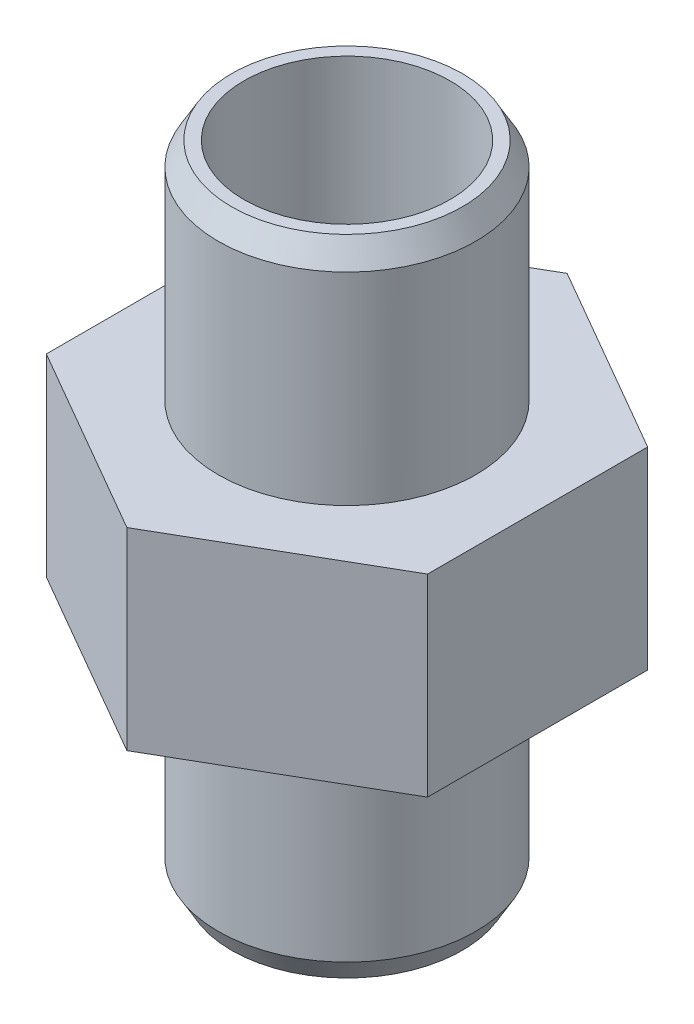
SolidWorks part; units mm, degrees
ref_plane "Front Plane" through (0, 0, 0) normal (0, 0, 1) x (1, 0, 0)
ref_plane "Top Plane" through (0, 0, 0) normal (0, 1, 0) x (1, 0, 0)
ref_plane "Right Plane" through (0, 0, 0) normal (1, 0, 0) x (0, 0, -1)
sketch "Sketch1" plane through (0, 0, 0) normal (0, 0, 1) x (1, 0, 0)
  line L0 (0, 27.4512) -> (0, -29.306) construction
  line L1 (0, 15.875) -> (6.35, 15.875)
  line L2 (6.35, 15.875) -> (6.35, 4.7625)
  line L3 (6.35, 4.7625) -> (12.7, 4.7625)
  line L4 (12.7, 4.7625) -> (12.7, -4.7625)
  line L5 (12.7, -4.7625) -> (6.35, -4.7625)
  line L6 (6.35, -4.7625) -> (6.35, -15.875)
  line L7 (6.35, -15.875) -> (0, -15.875)
  line L8 (0, 15.875) -> (0, -15.875)
  point P5 (12.7, 0)
  dimension "D1" = 12.7
  dimension "D2" = 9.525
  dimension "D3" = 31.75
  dimension "D4" = 15.875
  dimension "D5" = 25.4
revolve "Revolve1" add sketch "Sketch1" angle 360 about L0
sketch "Sketch2" plane through (0, 15.875, 0) normal (0, 1, 0) x (-1, 0, 0)
  circle A0 centre (0, 0) radius 5.08
  dimension "D1" = 10.16
extrude "Cut-Extrude1" cut sketch "Sketch2" against normal through all
sketch "Sketch3" plane through (0, 4.7625, 0) normal (0, 1, 0) x (-1, 0, 0)
  line L1 (0, 10.8519) -> (-9.398, 5.4259)
  line L2 (-9.398, 5.4259) -> (-9.398, -5.4259)
  line L3 (-9.398, -5.4259) -> (0, -10.8519)
  line L4 (0, -10.8519) -> (9.398, -5.4259)
  line L5 (9.398, -5.4259) -> (9.398, 5.4259)
  line L6 (9.398, 5.4259) -> (0, 10.8519)
  circle A0 centre (0, 0) radius 9.398 construction
  dimension "D1" = 18.796
extrude "Cut-Extrude2" cut sketch "Sketch3" against normal through all flip side to cut
chamfer "Chamfer1" distance 1.143 angle 30 1 edges at (0, 15.875, 6.35)
chamfer "Chamfer3" distance 1.143 angle 30 1 edges at (0, -15.875, 6.35)
